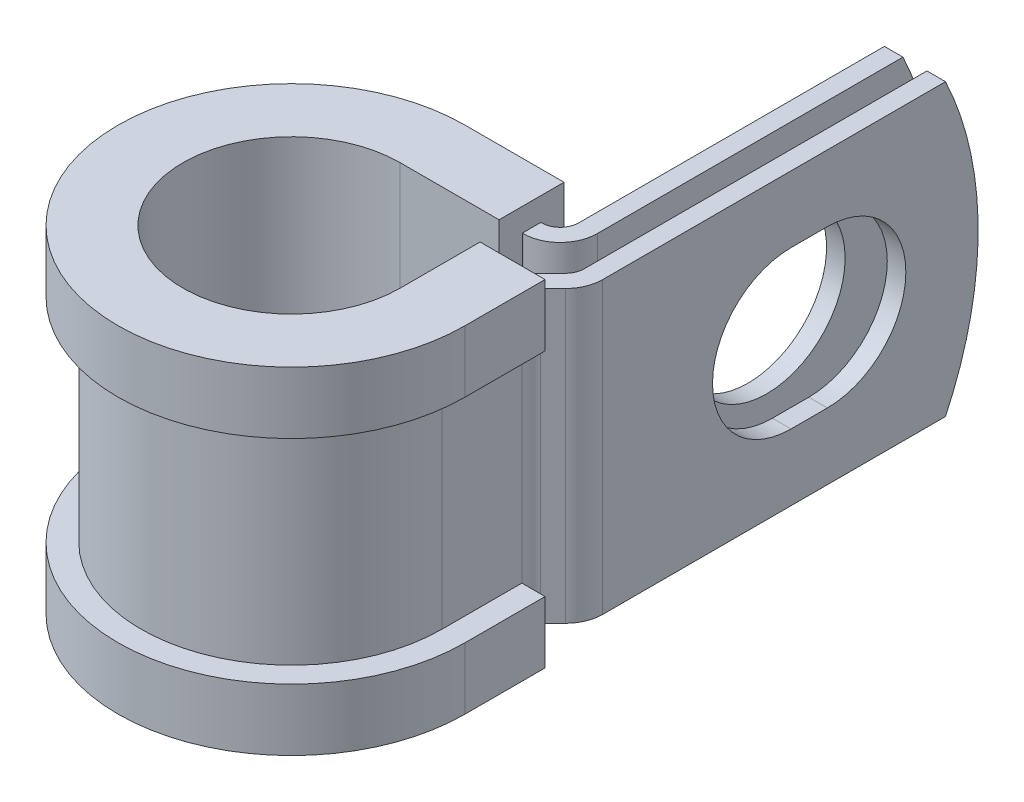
SolidWorks part; units mm, degrees
ref_plane "Front Plane" through (0, 0, 0) normal (0, 0, 1) x (1, 0, 0)
ref_plane "Top Plane" through (0, 0, 0) normal (0, 1, 0) x (1, 0, 0)
ref_plane "Right Plane" through (0, 0, 0) normal (1, 0, 0) x (0, 0, -1)
sketch "Sketch1" plane through (0, 0, 0) normal (0, 1, 0) x (1, 0, 0)
  line L0 (0, 8.6614) -> (6.5457, 8.6614)
  line L1 (8.6614, 0) -> (8.6614, 5.2489)
  line L2 (8.9841, 33.3248) -> (8.9841, 11.0998)
  line L3 (9.3756, 6.9731) -> (10.2018, 7.7993)
  line L5 (10.5589, 8.6614) -> (10.5589, 33.3248)
  arc A0 (0, 8.6614) -> (8.6614, 0) centre (0, 0) ccw
  arc A1 (9.3756, 6.9731) -> (8.6614, 5.2489) centre (11.0998, 5.2489) ccw
  arc A2 (10.2018, 7.7993) -> (10.5589, 8.6614) centre (9.3397, 8.6614) ccw
  arc A3 (6.5457, 8.6614) -> (8.9841, 11.0998) centre (6.5457, 11.0998) ccw
extrude "Extrude-Thin1" add sketch "Sketch1" along normal mid plane 19.05 thin
sketch "Sketch2" plane through (7.7649, 0, 0) normal (-1, 0, 0) x (0, 0, 1)
  line L0 (-33.3248, 9.525) -> (-33.3248, -9.525) construction
  line L1 (0, 9.525) -> (0, -9.525) construction
  circle A0 centre (-22.225, 0) radius 5.1562
  point P2 (-33.3248, 0)
extrude "Cut-Extrude1" cut sketch "Sketch2" against normal up to surface (1.2192 mm away)
sketch "Sketch3" plane through (11.7781, 0, 0) normal (1, 0, 0) x (0, 0, -1)
  line L0 (21.0312, 0) -> (23.4188, 0) construction
  line L1 (21.0312, 5.1562) -> (23.4188, 5.1562)
  line L2 (21.0312, -5.1562) -> (23.4188, -5.1562)
  line L3 (33.3248, 9.525) -> (33.3248, -9.525) construction
  arc A0 (21.0312, 5.1562) -> (21.0312, -5.1562) centre (21.0312, 0) ccw
  arc A1 (23.4188, -5.1562) -> (23.4188, 5.1562) centre (23.4188, 0) ccw
  point P3 (22.225, 0)
  point P8 (33.3248, 0)
  point P11 (15.875, 0)
  point P12 (28.575, 0)
extrude "Cut-Extrude2" cut sketch "Sketch3" against normal up to surface (1.2192 mm away)
sketch "Sketch4" plane through (7.7649, 0, 0) normal (-1, 0, 0) x (0, 0, 1)
  line L0 (-33.3248, 9.525) -> (-33.3248, -9.525)
  line L1 (-33.3248, 9.525) -> (-31.1803, 9.525)
  line L2 (-33.3248, 9.525) -> (-11.0998, 9.525) construction
  line L3 (-33.3248, -9.525) -> (-31.1803, -9.525)
  line L4 (-33.3248, -9.525) -> (-11.0998, -9.525) construction
  arc A0 (-31.1803, 9.525) -> (-31.1803, -9.525) centre (-11.0998, 0) ccw
extrude "Cut-Extrude3" cut sketch "Sketch4" against normal through all contours A0 M4 M5 | A0 L0 M2
ref_plane "Plane1" through (0, 0, -5.2489) normal (0, 0, -1) x (-1, 0, 0)
ref_plane "Plane2" through (6.4949, 0, 0) normal (-1, 0, 0) x (0, 0, 1)
sketch "Sketch5" plane through (0, 0, -5.2489) normal (0, 0, -1) x (-1, 0, 0)
  line L0 (-9.8806, 9.525) -> (-8.6614, 9.525)
  line L1 (-9.8806, 9.525) -> (-9.8806, -9.525) construction
  line L3 (-8.6614, 9.525) -> (-8.6614, -9.525)
  line L4 (-8.6614, -9.525) -> (-9.8806, -9.525)
  line L5 (-9.8806, -9.525) -> (-9.8806, -6.985)
  line L6 (-9.8806, 9.525) -> (-9.8806, 6.985)
  line L7 (-11.4046, 11.049) -> (-11.4046, 6.985)
  line L8 (-11.4046, 11.049) -> (-7.1374, 11.049)
  line L9 (-7.1374, 11.049) -> (-7.1374, -11.049)
  line L10 (-7.1374, -11.049) -> (-11.4046, -11.049)
  line L11 (-11.4046, -11.049) -> (-11.4046, -6.985)
  line L12 (-11.4046, 6.985) -> (-9.8806, 6.985)
  line L13 (-9.8806, -6.985) -> (-11.4046, -6.985)
sketch "Sketch6" plane through (0, 9.525, 0) normal (0, 1, 0) x (1, 0, 0)
  line L0 (7.1374, 0) -> (7.1374, 5.2489)
  line L1 (7.1374, 5.2489) -> (11.4046, 5.2489) construction
  line L2 (6.4949, 6.9878) -> (6.4949, -6.9878) construction
  line L5 (0, 7.1374) -> (6.4949, 7.1374)
  arc A0 (0, 7.1374) -> (7.1374, 0) centre (0, 0) ccw
sweep "Sweep1" add profiles "Sketch5" path "Sketch6"
equation "\"D4@Sketch5\" = \"D1@Extrude-Thin1\""
equation "\"D5@Sketch5\" = \"D5@Extrude-Thin1\""
equation "\"D1@Sketch3\" = \"D2@Sketch2\""
equation "\"D7@Sketch1\" = \"D3@Sketch2\" + \"D1@Sketch3\""
equation "\"D1@Sketch1\" = \"D1@Sketch6\" + 2 * \"D3@Sketch5\""
equation "\"D1@Sketch4\" = ( \"D1@Extrude-Thin1\" + .125 ) * 2"
equation "\"D9@Sketch1\"= \"D5@Extrude-Thin1\""
equation "\"D8@Sketch1\"= 2 * \"D5@Extrude-Thin1\""
equation "\"D2@Sketch1\" = 2 * \"D5@Extrude-Thin1\""
equation "\"D2@Sketch3\" = \"D1@Sketch2\""
